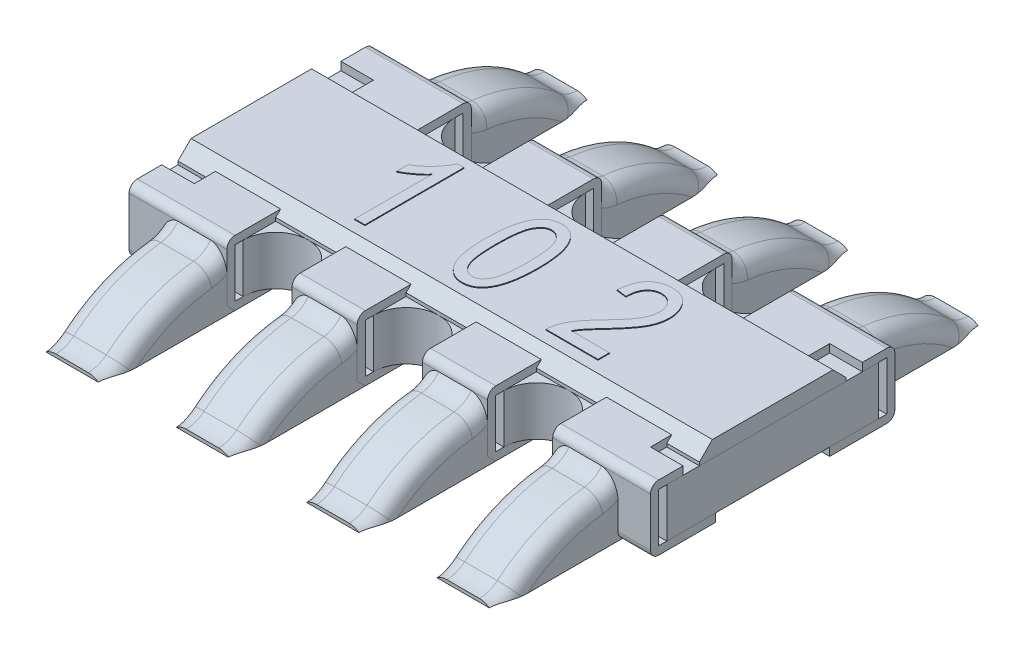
SolidWorks part; units mm, degrees
ref_plane "Front Plane" through (0, 0, 0) normal (0, 0, 1) x (1, 0, 0)
ref_plane "Top Plane" through (0, 0, 0) normal (0, 1, 0) x (1, 0, 0)
ref_plane "Right Plane" through (0, 0, 0) normal (1, 0, 0) x (0, 0, -1)
sketch "Sketch5" plane through (0, 0, 0) normal (1, 0, 0) x (0, 0, -1)
  line L0 (55, 0) -> (-55, 0) construction
  line L1 (-0.7, 0.4) -> (0.7, 0.4)
  line L2 (-0.75, 0.35) -> (-0.75, 0.05)
  line L3 (-0.7, 0) -> (-0.35, 0)
  line L4 (0.75, 0.35) -> (0.75, 0.05)
  line L5 (0, 55) -> (0, -55) construction
  line L8 (0.35, 0) -> (0.7, 0)
  arc A0 (0.7, 0.4) -> (0.75, 0.35) centre (0.7, 0.35) cw
  arc A1 (0.7, 0) -> (0.75, 0.05) centre (0.7, 0.05) ccw
  arc A2 (-0.75, 0.05) -> (-0.7, 0) centre (-0.7, 0.05) ccw
  arc A3 (-0.7, 0.4) -> (-0.75, 0.35) centre (-0.7, 0.35) ccw
  point P10 (0.75, 0.4)
  point P13 (0.75, 0)
  point P18 (-0.75, 0.4)
  dimension "D4" = 0.05
  dimension "D1" = 0.4
  dimension "D2" = 1.5
  dimension "D3" = 0.75
  dimension "D5" = 0.4
  dimension "D6" = 0.4
extrude "Extrude-Thin1" add sketch "Sketch5" along normal mid plane 3.2 thin
sketch "Sketch6" plane through (0, 0.4, 0) normal (0, 1, 0) x (1, 0, 0)
  line L1 (1.6, 0.75) -> (-1.6, 0.75) construction
  line L2 (-1, 0.75) -> (-0.6, 0.75)
  line L3 (-1, 0.75) -> (-1, 0.25)
  line L4 (-1, 0.25) -> (-0.6, 0.25)
  line L6 (-0.6, 0.75) -> (-0.6, 0.25)
  line L7 (0, -0.22) -> (0, 0.22) construction
  line L8 (-0.2, 0.75) -> (0.2, 0.75)
  line L9 (-0.2, 0.75) -> (-0.2, 0.25)
  line L10 (-0.2, 0.25) -> (0.2, 0.25)
  line L11 (0.2, 0.75) -> (0.2, 0.25)
  line L12 (0.6, 0.75) -> (1, 0.75)
  line L13 (0.6, 0.75) -> (0.6, 0.25)
  line L14 (0.6, 0.25) -> (1, 0.25)
  line L15 (1, 0.75) -> (1, 0.25)
  line L16 (1.6, 0.7) -> (1.6, -0.7) construction
  line L18 (1.6, -0.75) -> (-1.6, -0.75) construction
  line L19 (-1, -0.75) -> (-0.6, -0.75)
  line L20 (-1, -0.75) -> (-1, -0.25)
  line L21 (-1, -0.25) -> (-0.6, -0.25)
  line L22 (-0.6, -0.75) -> (-0.6, -0.25)
  line L24 (-0.2, -0.75) -> (0.2, -0.75)
  line L25 (-0.2, -0.75) -> (-0.2, -0.25)
  line L26 (-0.2, -0.25) -> (0.2, -0.25)
  line L27 (0.2, -0.75) -> (0.2, -0.25)
  line L28 (0.6, -0.75) -> (1, -0.75)
  line L29 (0.6, -0.75) -> (0.6, -0.25)
  line L30 (0.6, -0.25) -> (1, -0.25)
  line L31 (1, -0.75) -> (1, -0.25)
  dimension "D1" = 0.5
  dimension "D2" = 0.4
  dimension "D3" = 0.8
  dimension "D4" = 0.2
  dimension "D5" = 0.8
  dimension "D6" = 0.4
  dimension "D7" = 0.4
  dimension "D8" = 0.6
extrude "Cut-Extrude3" cut sketch "Sketch6" against normal through all
sketch "Sketch7" plane through (0, 0.4, 0) normal (0, 1, 0) x (1, 0, 0)
  line L0 (-1.6, 0.7) -> (-1.6, -0.7) construction
  line L1 (-1.6, -0.55) -> (-1.4, -0.55)
  line L2 (-1.6, -0.55) -> (-1.6, 0.55)
  line L3 (-1.6, 0.55) -> (-1.4, 0.55)
  line L4 (-1.4, -0.55) -> (-1.4, 0.55)
  line L5 (1.6, 0.7) -> (1.6, -0.7) construction
  line L6 (1.6, -0.55) -> (1.4, -0.55)
  line L7 (1.6, -0.55) -> (1.6, 0.55)
  line L8 (1.6, 0.55) -> (1.4, 0.55)
  line L9 (1.4, -0.55) -> (1.4, 0.55)
  line L12 (-0.22, 0) -> (0.22, 0) construction
  dimension "D1" = 0.55
  dimension "D2" = 1.1
  dimension "D3" = 0.2
extrude "Cut-Extrude4" cut sketch "Sketch7" against normal blind 0.1
sketch "Sketch1" plane through (0, 0.05, 0) normal (0, 1, 0) x (1, 0, 0)
  line L0 (-1.6, -0.65) -> (1.6, 0.65) construction
  line L1 (-1.6, 0.65) -> (1.6, 0.65)
  line L2 (-1.6, 0.65) -> (-1.6, -0.65)
  line L3 (-1.6, -0.65) -> (1.6, -0.65)
  line L4 (1.6, 0.65) -> (1.6, -0.65)
  line L5 (-1.2, 0.65) -> (-1.2, -0.65) construction
  line L6 (-1.6, 0.45) -> (1.6, 0.45) construction
  line L7 (-0.4, 0.65) -> (-0.4, -0.65) construction
  line L8 (-1.6, -0.45) -> (1.6, -0.45) construction
  line L9 (0.4, 0.65) -> (0.4, -0.65) construction
  line L10 (0, -0.22) -> (0, 0.22) construction
  line L11 (1.2, 0.65) -> (1.2, -0.65) construction
  dimension "D3" = 0.2
  dimension "D1" = 3.2
  dimension "D2" = 1.3
  dimension "D4" = 0.2
  dimension "D5" = 0.8
  dimension "D6" = 0.8
  dimension "D7" = 0.8
  dimension "D8" = 0.4
extrude "Boss-Extrude3" add sketch "Sketch1" along normal blind 0.3 separate body
sketch "Sketch9" plane through (0, 0.35, 0) normal (0, 1, 0) x (1, 0, 0)
  line L1 (-1.6, 0.45) -> (1.6, 0.45)
  line L2 (-1.6, 0.45) -> (-1.6, -0.45)
  line L3 (-1.6, -0.45) -> (1.6, -0.45)
  line L4 (1.6, 0.45) -> (1.6, -0.45)
extrude "Boss-Extrude4" add sketch "Sketch9" along normal blind 0.1
chamfer "Chamfer1" distance 0.08 angle 45 2 edges at (0, 0.45, 0.45) (0, 0.45, -0.45)
sketch "Sketch10" plane through (0, 0.05, 0) normal (0, 1, 0) x (1, 0, 0)
  line L0 (-1.6, 0.65) -> (1.6, 0.65) construction
  line L1 (-1.6, -0.65) -> (1.6, -0.65) construction
  line L2 (0, -0.2475) -> (0, 0.2475) construction
  circle A0 centre (-0.8, 0.65) radius 0.2
  circle A1 centre (0, 0.65) radius 0.2
  circle A2 centre (0.8, 0.65) radius 0.2
  circle A3 centre (0.8, -0.65) radius 0.2
  circle A4 centre (0, -0.65) radius 0.2
  circle A5 centre (-0.8, -0.65) radius 0.2
  dimension "D3" = 0.4
  dimension "D1" = 0.8
  dimension "D2" = 0.8
extrude "Cut-Extrude7" cut sketch "Sketch10" along normal blind 5
sketch "Sketch11" plane through (0, 0.45, 0) normal (0, 1, 0) x (1, 0, 0)
  line L0 (0, -0.2475) -> (0, 0.2475) construction
  line L2 (-0.2475, 0) -> (0.2475, 0) construction
  text T0 "1 0 2" font "Arial Narrow" height 0.6
  dimension "D1" = 0.86
  dimension "D2" = 0.3
extrude "Boss-Extrude5" add sketch "Sketch11" along normal blind 0.005
ref_plane "Plane1" through (-1.2, 0, 0) normal (1, 0, 0) x (0, 0, -1)
sketch "Sketch12" plane through (-1.2, 0, 0) normal (1, 0, 0) x (0, 0, -1)
  line L0 (-0.75, 0.35) -> (-0.75, 0.05)
  line L1 (-0.75, 0.05) -> (-0.7, 0)
  line L2 (1.2375, 0) -> (-1.2375, 0) construction
  line L3 (-0.7, 0) -> (-1.5, 0)
  line L4 (-1.5, 0) -> (-1.5, 0.02)
  line L5 (0, 0.2503) -> (0, -0.2503) construction
  line L6 (0.75, 0.05) -> (0.7, 0)
  line L7 (0.7, 0) -> (1.5, 0)
  line L8 (1.5, 0) -> (1.5, 0.02)
  line L9 (0.75, 0.35) -> (0.75, 0.05)
  arc A0 (-0.75, 0.05) -> (-0.7, 0) centre (-0.7, 0.05) ccw construction
  arc A1 (-1.5, 0.02) -> (-1.3904, 0.06) centre (-1.5, 0.19) ccw
  arc A2 (-1.3904, 0.06) -> (-0.8548, 0.2894) centre (-0.746, -0.7047) cw
  arc A3 (-0.8548, 0.2894) -> (-0.75, 0.35) centre (-0.8711, 0.4385) ccw
  arc A4 (1.5, 0.02) -> (1.3904, 0.06) centre (1.5, 0.19) cw
  arc A5 (1.3904, 0.06) -> (0.8548, 0.2894) centre (0.746, -0.7047) ccw
  arc A6 (0.8548, 0.2894) -> (0.75, 0.35) centre (0.8711, 0.4385) cw
  dimension "D2" = 0.15
  dimension "D3" = 0.17
  dimension "D4" = 1
  dimension "D1" = 0.02
  dimension "D5" = 1.5
  dimension "D6" = 0.7047
  dimension "D7" = 1.5
extrude "Boss-Extrude6" add sketch "Sketch12" along normal mid plane 0.4 separate body
fillet "Fillet1" radius 0.1 6 edges at (-1.4, 0.3087, 0.796) (-1.4, 0.0303, 1.4417) (-1, 0.3087, 0.796) (-1, 0.0303, 1.4417) (-1.4, 0.2146, 1.1397) (-1, 0.2146, 1.1397)
fillet "Fillet2" radius 0.1 6 edges at (-1, 0.0303, -1.4417) (-1, 0.3087, -0.796) (-1.4, 0.0303, -1.4417) (-1.4, 0.3087, -0.796) (-1, 0.2146, -1.1397) (-1.4, 0.2146, -1.1397)
pattern_linear "LPattern3" count 4 spacing 0.8 along (1, 0, 0)
